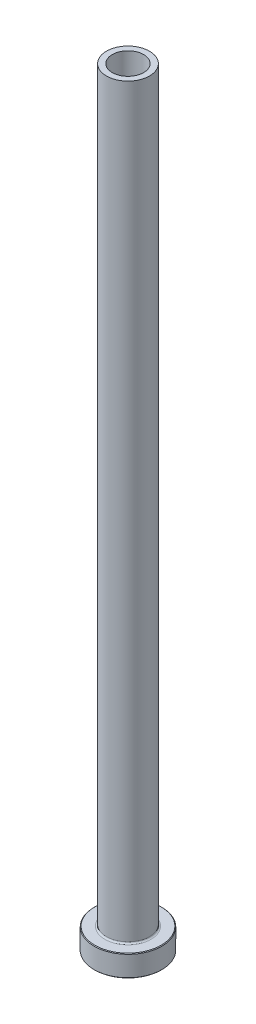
SolidWorks part; units mm, degrees
ref_plane "Front Plane" through (0, 0, 0) normal (0, 0, 1) x (1, 0, 0)
ref_plane "Top Plane" through (0, 0, 0) normal (0, 1, 0) x (1, 0, 0)
ref_plane "Right Plane" through (0, 0, 0) normal (1, 0, 0) x (0, 0, -1)
sketch "Sketch1" plane through (0, 0, 0) normal (0, 0, 1) x (1, 0, 0)
  line L0 (-5.1, 250) -> (-7, 250)
  line L1 (-7, 250) -> (-7, 7)
  line L2 (-7, 7) -> (-11, 7)
  line L3 (-11, 7) -> (-11, 0)
  line L4 (12.1, 0) -> (-12.1, 0) construction
  line L5 (-11, 0) -> (-5.35, 0)
  line L6 (-5.1, 195) -> (-5.1, 250)
  line L7 (0, 92.1877) -> (0, -15.5353) construction
  line L8 (0, -12.1) -> (0, 12.1) construction
  line L9 (-5.1, 195) -> (-5.35, 183)
  line L10 (-5.35, 183) -> (-5.35, 0)
  dimension "D1" = 0.25
  dimension "ID" = 10.2
  dimension "OD" = 14
  dimension "L" = 250
  dimension "H" = 22
  dimension "T" = 7
  dimension "N" = 55
  dimension "D2" = 12
revolve "Revolve1" add sketch "Sketch1" angle 360 about L7
fillet "Fillet1" radius 0.5 1 edges at (0, 7, 7)
chamfer "Chamfer1" distance 0.2 angle 45 2 edges at (0, 7, 11) (0, 0, 11)
chamfer "Chamfer3" distance 0.5 angle 45 1 edges at (0, 0, 5.35)
